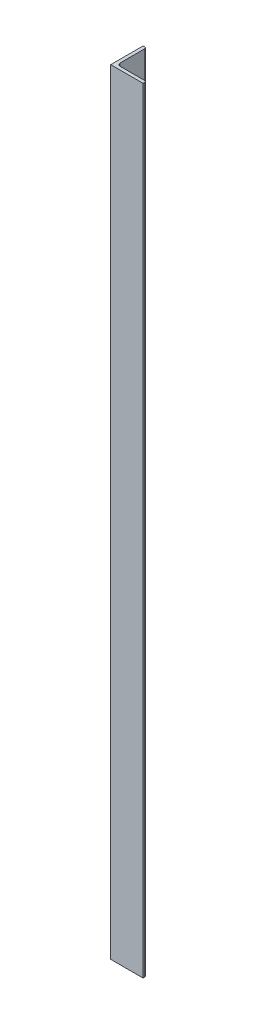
SolidWorks part; units mm, degrees
ref_plane "Plan de face" through (0, 0, 0) normal (0, 0, 1) x (1, 0, 0)
ref_plane "Plan de dessus" through (0, 0, 0) normal (0, 1, 0) x (1, 0, 0)
ref_plane "Plan de droite" through (0, 0, 0) normal (1, 0, 0) x (0, 0, -1)
sketch "Esquisse1" plane through (0, 0, 0) normal (0, 1, 0) x (1, 0, 0)
  line L0 (-2.5, 47.5) -> (-2.5, -2.5)
  line L1 (-2.5, -2.5) -> (47.5, -2.5)
  line L2 (47.5, -2.5) -> (47.5, 0)
  line L3 (45, 2.5) -> (7.5, 2.5)
  line L4 (2.5, 7.5) -> (2.5, 45)
  line L5 (-2.5, 47.5) -> (0, 47.5)
  line L6 (0, 30.2572) -> (0, -39.7232) construction
  line L7 (27.2146, 0) -> (-38.3709, 0) construction
  arc A0 (2.5, 7.5) -> (7.5, 2.5) centre (7.5, 7.5) ccw
  arc A1 (45, 2.5) -> (47.5, 0) centre (45, 0) cw
  arc A2 (0, 47.5) -> (2.5, 45) centre (0, 45) cw
  point P15 (47.5, 2.5)
  point P18 (2.5, 47.5)
  dimension "D5" = 5
  dimension "D6" = 2.5
  dimension "D1" = 5
  dimension "D2" = 5
  dimension "D3" = 50
  dimension "D4" = 50
extrude "Extrusion1" add sketch "Esquisse1" along normal blind 1200
